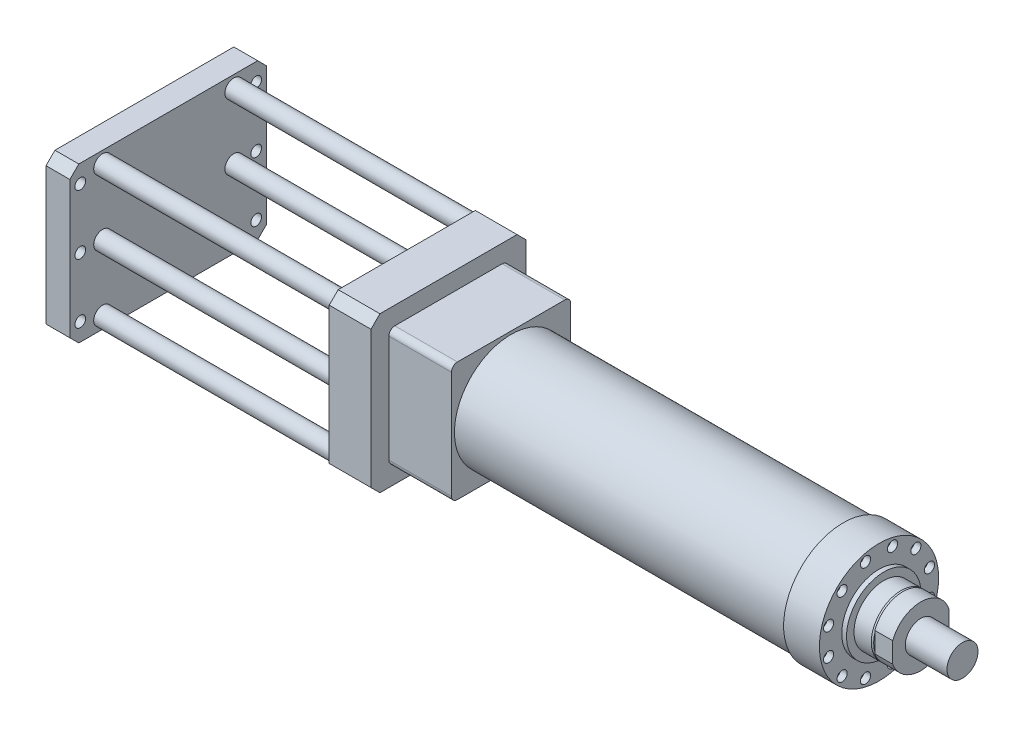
SolidWorks part; units mm, degrees
ref_plane "前视基准面" through (0, 0, 0) normal (0, 0, 1) x (1, 0, 0)
ref_plane "上视基准面" through (0, 0, 0) normal (0, 1, 0) x (1, 0, 0)
ref_plane "右视基准面" through (0, 0, 0) normal (1, 0, 0) x (0, 0, -1)
sketch "草图1" plane through (0, 0, 0) normal (1, 0, 0) x (0, 0, -1)
  circle A0 centre (0, 0) radius 80
  circle A1 centre (0, 0) radius 95
  dimension "D1" = 190
  dimension "D2" = 160
extrude "凸台-拉伸1" add sketch "草图1" along normal blind 557
sketch "草图2" plane through (557, 0, 0) normal (1, 0, 0) x (0, 0, -1)
  circle A0 centre (0, 0) radius 100
  dimension "D1" = 200
extrude "凸台-拉伸2" add sketch "草图2" along normal blind 60
sketch "草图3" plane through (617, 0, 0) normal (1, 0, 0) x (0, 0, -1)
  circle A0 centre (0, 0) radius 62.5
  dimension "D1" = 125
extrude "凸台-拉伸3" add sketch "草图3" along normal blind 8
sketch "草图4" plane through (617, 0, 0) normal (1, 0, 0) x (0, 0, -1)
  line L0 (0, 0) -> (0, 177.9426) construction
  line L1 (0, 0) -> (-182.6844, 0) construction
  line L2 (0, 0) -> (-40.3471, 150.5773) construction
  line L3 (0, 0) -> (-50.7607, 156.2254) construction
  circle A0 centre (0, 0) radius 87.5 construction
  circle A1 centre (-22.6467, 84.5185) radius 5.5
  circle A2 centre (-22.6467, 84.5185) radius 8.5
  circle A3 centre (0, 0) radius 112.5 construction
  circle A4 centre (-34.7644, 106.9939) radius 9
  circle A5 centre (34.7644, 106.9939) radius 9
  circle A6 centre (91.0144, 66.1258) radius 9
  circle A7 centre (112.5, 0) radius 9
  circle A8 centre (91.0144, -66.1258) radius 9
  circle A9 centre (34.7644, -106.9939) radius 9
  circle A10 centre (-34.7644, -106.9939) radius 9
  circle A11 centre (-91.0144, -66.1258) radius 9
  circle A12 centre (-112.5, 0) radius 9
  circle A13 centre (-91.0144, 66.1258) radius 9
  circle A14 centre (22.6467, 84.5185) radius 8.5
  circle A15 centre (22.6467, 84.5185) radius 5.5
  circle A16 centre (61.8718, 61.8718) radius 8.5
  circle A17 centre (61.8718, 61.8718) radius 5.5
  circle A18 centre (84.5185, 22.6467) radius 8.5
  circle A19 centre (84.5185, 22.6467) radius 5.5
  circle A20 centre (84.5185, -22.6467) radius 8.5
  circle A21 centre (84.5185, -22.6467) radius 5.5
  circle A22 centre (61.8718, -61.8718) radius 8.5
  circle A23 centre (61.8718, -61.8718) radius 5.5
  circle A24 centre (22.6467, -84.5185) radius 8.5
  circle A25 centre (22.6467, -84.5185) radius 5.5
  circle A26 centre (-22.6467, -84.5185) radius 8.5
  circle A27 centre (-22.6467, -84.5185) radius 5.5
  circle A28 centre (-61.8718, -61.8718) radius 8.5
  circle A29 centre (-61.8718, -61.8718) radius 5.5
  circle A30 centre (-84.5185, -22.6467) radius 8.5
  circle A31 centre (-84.5185, -22.6467) radius 5.5
  circle A32 centre (-84.5185, 22.6467) radius 8.5
  circle A33 centre (-84.5185, 22.6467) radius 5.5
  circle A34 centre (-61.8718, 61.8718) radius 8.5
  circle A35 centre (-61.8718, 61.8718) radius 5.5
  point P33 (0, 0)
  point P67 (0, 0)
  dimension "D1" = 175
  dimension "D3" = 11
  dimension "D4" = 17
  dimension "D5" = 225
  dimension "D7" = 18
  dimension "D2" = 15
  dimension "D6" = 18
  dimension "D8" = 10
  dimension "D9" = 12
extrude "切除-拉伸3" cut sketch "草图4" against normal blind 11 contours A2 | A34 | A32 | A30 | A28 | A26 | A24 | A22 | A20 | A18 | A16 | A14
sketch "草图6" plane through (625, 0, 0) normal (1, 0, 0) x (0, 0, -1)
  circle A0 centre (0, 0) radius 50
  dimension "D1" = 100
extrude "凸台-拉伸4" add sketch "草图6" along normal blind 32
chamfer "倒角1" distance 3 angle 20 1 edges at (657, 0, -50)
sketch "草图7" plane through (657, 0, 0) normal (1, 0, 0) x (0, 0, -1)
  line L2 (-47, 17.0587) -> (-47, -17.0587)
  line L4 (47, 17.0587) -> (47, -17.0587)
  line L5 (-30.7317, 39.4406) -> (30.7317, -39.4406) construction
  line L6 (-30.7317, -39.4406) -> (30.7317, 39.4406) construction
  arc A0 (-47, -17.0587) -> (47, -17.0587) centre (0, 0) ccw
  arc A1 (47, 17.0587) -> (-47, 17.0587) centre (0, 0) ccw
  dimension "D1" = 100
extrude "凸台-拉伸5" add sketch "草图7" along normal blind 30 contours A1 L2 A0 L4
sketch "草图8" plane through (687, 0, 0) normal (1, 0, 0) x (0, 0, -1)
  circle A0 centre (0, 0) radius 26
  dimension "D1" = 52
extrude "切除-拉伸4" cut sketch "草图8" against normal blind 82
sketch "草图9" plane through (0, 0, 0) normal (-1, 0, 0) x (0, 0, 1)
  line L1 (-90, 100) -> (90, 100)
  line L2 (-100, 90) -> (-100, -90)
  line L3 (-90, -100) -> (90, -100)
  line L4 (100, 90) -> (100, -90)
  line L5 (-100, 100) -> (100, -100) construction
  line L6 (-100, -100) -> (100, 100) construction
  arc A0 (100, -90) -> (90, -100) centre (90, -90) cw
  arc A1 (-90, -100) -> (-100, -90) centre (-90, -90) cw
  arc A2 (100, 90) -> (90, 100) centre (90, 90) ccw
  arc A3 (-100, 90) -> (-90, 100) centre (-90, 90) cw
  point P0 (0, 0)
  dimension "D3" = 10
  dimension "D1" = 200
  dimension "D2" = 200
extrude "凸台-拉伸6" add sketch "草图9" along normal blind 105
sketch "草图10" plane through (-105, 0, 0) normal (-1, 0, 0) x (0, 0, 1)
  line L5 (-130, 130) -> (130, 130)
  line L6 (-130, 130) -> (-130, -130)
  line L7 (-130, -130) -> (130, -130)
  line L8 (130, 130) -> (130, -130)
  line L9 (-130, 130) -> (130, -130) construction
  line L10 (-130, -130) -> (130, 130) construction
  point P0 (0, 0)
  dimension "D1" = 260
  dimension "D2" = 260
extrude "凸台-拉伸7" add sketch "草图10" along normal blind 70 separate body
sketch "草图11" plane through (-175, 0, 0) normal (-1, 0, 0) x (0, 0, 1)
  circle A0 centre (0, 0) radius 65
  dimension "D1" = 130
extrude "切除-拉伸5" cut sketch "草图11" against normal blind 30
sketch "草图12" plane through (-145, 0, 0) normal (-1, 0, 0) x (0, 0, 1)
  circle A0 centre (0, 0) radius 55
  dimension "D1" = 110
extrude "切除-拉伸6" cut sketch "草图12" against normal blind 31
sketch "草图13" plane through (-175, 0, 0) normal (-1, 0, 0) x (0, 0, 1)
  line L0 (0, 0) -> (0, 151.8431) construction
  line L1 (0, 0) -> (-171.834, 0) construction
  line L2 (0, 0) -> (-102.8659, 102.8659) construction
  circle A0 centre (0, 0) radius 82.5 construction
  circle A1 centre (-58.3363, 58.3363) radius 5
  circle A2 centre (58.3363, 58.3363) radius 5
  circle A3 centre (58.3363, -58.3363) radius 5
  circle A4 centre (-58.3363, -58.3363) radius 5
  circle A5 centre (0, 0) radius 87.5 construction
  circle A6 centre (0, 87.5) radius 5.5
  circle A7 centre (0, 87.5) radius 8.5
  circle A8 centre (43.75, 75.7772) radius 8.5
  circle A9 centre (43.75, 75.7772) radius 5.5
  circle A10 centre (75.7772, 43.75) radius 8.5
  circle A11 centre (75.7772, 43.75) radius 5.5
  circle A12 centre (87.5, 0) radius 8.5
  circle A13 centre (87.5, 0) radius 5.5
  circle A14 centre (75.7772, -43.75) radius 8.5
  circle A15 centre (75.7772, -43.75) radius 5.5
  circle A16 centre (43.75, -75.7772) radius 8.5
  circle A17 centre (43.75, -75.7772) radius 5.5
  circle A18 centre (0, -87.5) radius 8.5
  circle A19 centre (0, -87.5) radius 5.5
  circle A20 centre (-43.75, -75.7772) radius 8.5
  circle A21 centre (-43.75, -75.7772) radius 5.5
  circle A22 centre (-75.7772, -43.75) radius 8.5
  circle A23 centre (-75.7772, -43.75) radius 5.5
  circle A24 centre (-87.5, 0) radius 8.5
  circle A25 centre (-87.5, 0) radius 5.5
  circle A26 centre (-75.7772, 43.75) radius 8.5
  circle A27 centre (-75.7772, 43.75) radius 5.5
  circle A28 centre (-43.75, 75.7772) radius 8.5
  circle A29 centre (-43.75, 75.7772) radius 5.5
  point P17 (0, 0)
  point P54 (0, 0)
  dimension "D1" = 165
  dimension "D3" = 10
  dimension "D5" = 175
  dimension "D6" = 11
  dimension "D7" = 17
  dimension "D2" = 45
  dimension "D4" = 4
  dimension "D8" = 12
extrude "切除-拉伸7" cut sketch "草图13" against normal blind 20 contours A1 | A2 | A3 | A4
sketch "草图14" plane through (687, 0, 0) normal (1, 0, 0) x (0, 0, -1)
  circle A0 centre (0, 0) radius 26
  dimension "D1" = 52
extrude "凸台-拉伸8" add sketch "草图14" along normal blind 70
sketch "草图15" plane through (-175, 0, 0) normal (-1, 0, 0) x (0, 0, 1)
  line L0 (0, 0) -> (0, 47.4181) construction
  line L1 (-165, 130) -> (165, 130)
  line L2 (-165, 130) -> (-165, -130)
  line L3 (-165, -130) -> (165, -130)
  line L4 (165, 130) -> (165, -130)
  line L5 (-165, 130) -> (165, -130) construction
  line L6 (-165, -130) -> (165, 130) construction
  circle A0 centre (-147.5, 100) radius 9
  circle A1 centre (-147.5, 0) radius 9
  circle A2 centre (-147.5, -100) radius 9
  circle A3 centre (147.5, -100) radius 9
  circle A4 centre (147.5, 0) radius 9
  circle A5 centre (147.5, 100) radius 9
  point P0 (0, 0)
  dimension "D7" = 18
  dimension "D8" = 18
  dimension "D9" = 18
  dimension "D1" = 330
  dimension "D2" = 260
  dimension "D3" = 200
  dimension "D4" = 30
  dimension "D5" = 100
  dimension "D6" = 17.5
extrude "凸台-拉伸9" add sketch "草图15" along normal blind 40 from offset 400 separate body
sketch "草图16" plane through (-175, 0, 0) normal (-1, 0, 0) x (0, 0, 1)
  line L0 (0, 0) -> (0, 27.0633) construction
  circle A0 centre (110, 110) radius 15
  circle A1 centre (110, -110) radius 15
  circle A2 centre (-110, 0) radius 15
  circle A3 centre (-110, -110) radius 15
  circle A4 centre (-110, 110) radius 15
  circle A5 centre (110, 0) radius 15
  dimension "D1" = 30
  dimension "D2" = 30
  dimension "D7" = 30
  dimension "D8" = 30
  dimension "D3" = 110
  dimension "D4" = 110
  dimension "D5" = 110
  dimension "D6" = 110
  dimension "D9" = 110
  dimension "D10" = 110
extrude "凸台-拉伸10" add sketch "草图16" along normal blind 400
chamfer "倒角2" distance 15 angle 45 4 edges at (-140, 130, -130) (-140, -130, -130) (-140, -130, 130) (-140, 130, 130)
chamfer "倒角3" distance 15 angle 45 4 edges at (-595, 130, -165) (-595, -130, -165) (-595, -130, 165) (-595, 130, 165)
